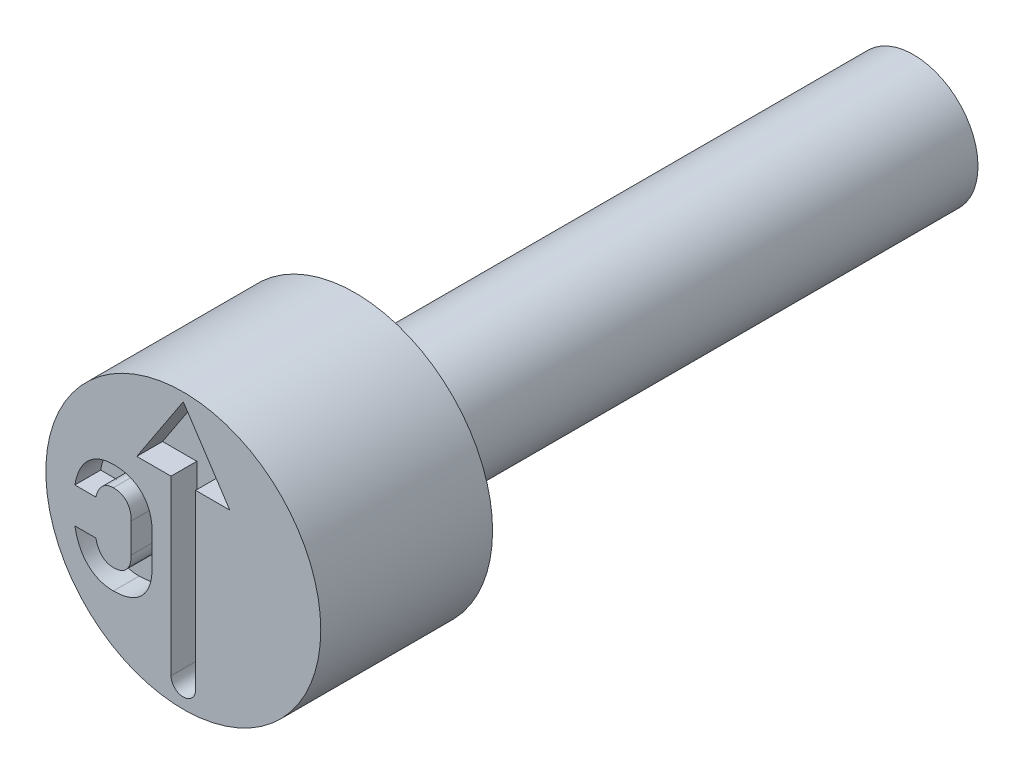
SolidWorks part; units mm, degrees
ref_plane "Front Plane" through (0, 0, 0) normal (0, 0, 1) x (1, 0, 0)
ref_plane "Top Plane" through (0, 0, 0) normal (0, 1, 0) x (1, 0, 0)
ref_plane "Right Plane" through (0, 0, 0) normal (1, 0, 0) x (0, 0, -1)
sketch "Sketch2" plane through (0, 0, 0) normal (1, 0, 0) x (0, 0, -1)
  line L0 (0.4039, 0) -> (50000.4039, 0) construction
  line L6 (0, 3.2) -> (0, 0)
  line L7 (4, 3.2) -> (0, 3.2)
  line L8 (4, 1.5) -> (4, 3.2)
  line L9 (17, 1.5) -> (4, 1.5)
  line L10 (17, 0) -> (17, 1.5)
  line L11 (0, 0) -> (17, 0)
  dimension "D1" = 6.4
  dimension "D2" = 3
  dimension "D3" = 17
  dimension "D4" = 4
revolve "Revolve1" add sketch "Sketch2" angle 360 about L0
sketch "Sketch3" plane through (0, 0, 0) normal (0, 0, 1) x (1, 0, 0)
  line L0 (0, 0) -> (0, 150000) construction
  line L1 (0.2857, 1.3595) -> (0.2857, -2.6642)
  line L2 (1.0829, 1.3595) -> (0.2857, 1.3595)
  line L3 (0, 3.0032) -> (1.0829, 1.3595)
  line L15 (0, 3.0032) -> (-1.0829, 1.3595)
  line L16 (-1.0829, 1.3595) -> (-0.2857, 1.3595)
  line L17 (-0.2857, 1.3595) -> (-0.2857, -2.6642)
  arc A2 (-0.2857, -2.6642) -> (0.2857, -2.6642) centre (0, -2.6642) ccw
extrude "Cut-Extrude4" cut sketch "Sketch3" against normal blind 0.6
sketch "Sketch4" plane through (0, 0, 0) normal (0, 0, 1) x (1, 0, 0)
  text T0 "C" font "Bahnschrift" height 2.5
  dimension "D1" = 1.6
  dimension "D2" = 0.5
extrude "Cut-Extrude5" cut sketch "Sketch4" against normal blind 0.6
